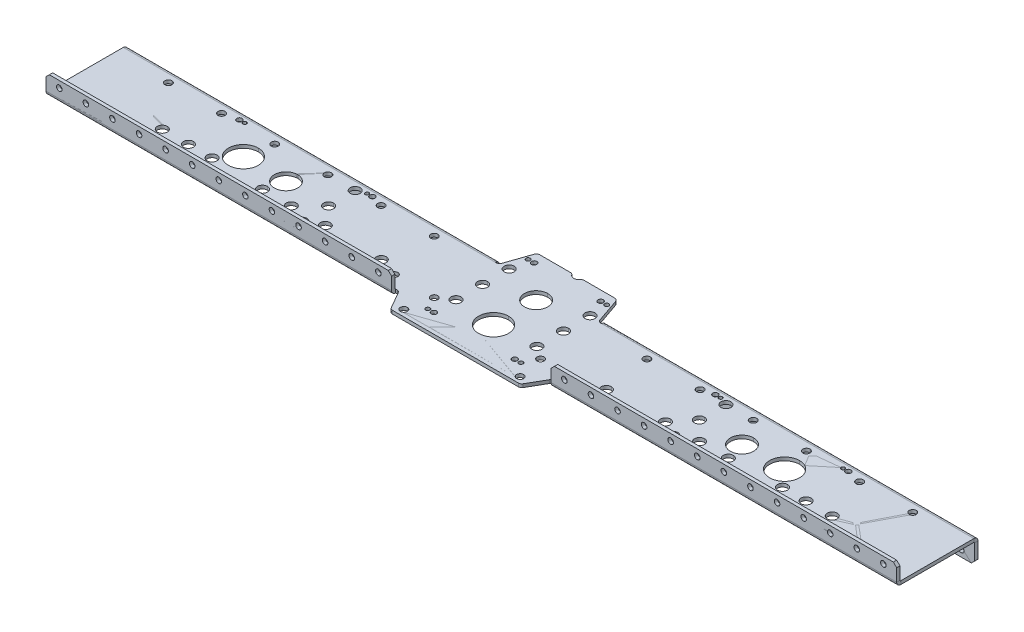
SolidWorks part; units mm, degrees
ref_plane "Front Plane" through (0, 0, 0) normal (0, 0, 1) x (1, 0, 0)
ref_plane "Top Plane" through (0, 0, 0) normal (0, 1, 0) x (1, 0, 0)
ref_plane "Right Plane" through (0, 0, 0) normal (1, 0, 0) x (0, 0, -1)
imported_body "am-3922a AM14U4 Inside Plate.STEP<1>"
hole_wizard "#7 (0.201) Diameter Hole1" positions "Sketch1" profile "Sketch2" hole size "#7" standard "ANSI Inch"
sketch "Sketch1" plane through (0, 3.175, 0) normal (0, 1, 0) x (1, 0, 0)
  line L0 (0, -0.762) -> (330.2, -0.762) construction
  line L1 (0, 69.85) -> (0, 0) construction
  line L2 (406.4, 93.9165) -> (406.4, -19.05) construction
  line L3 (466.5934, -19.05) -> (346.2066, -19.05) construction
  arc A0 (402.5069, 95.9358) -> (410.2931, 95.9358) centre (406.4, 98.679) ccw construction
  point P2 (68.8162, 26.6979)
  point P19 (743.9838, 26.6979)
  dimension "D2" = 27.4599
  dimension "D3" = 68.8162
sketch "Sketch2" plane through (68.8162, 3.175, -26.6979) normal (1, 0, 0) x (0, 0, 1)
  line L0 (0, 0) -> (0, 22.225)
  line L1 (0, 22.225) -> (2.5527, 22.225)
  line L2 (2.5527, 22.225) -> (2.5527, 0)
  line L5 (2.5527, 0) -> (0, 0)
  line L11 (0, -6.35) -> (0, 107.95) construction
  dimension "Thru Hole Dia." = 5.1054
  dimension "Thru Hole Depth" = 22.225
